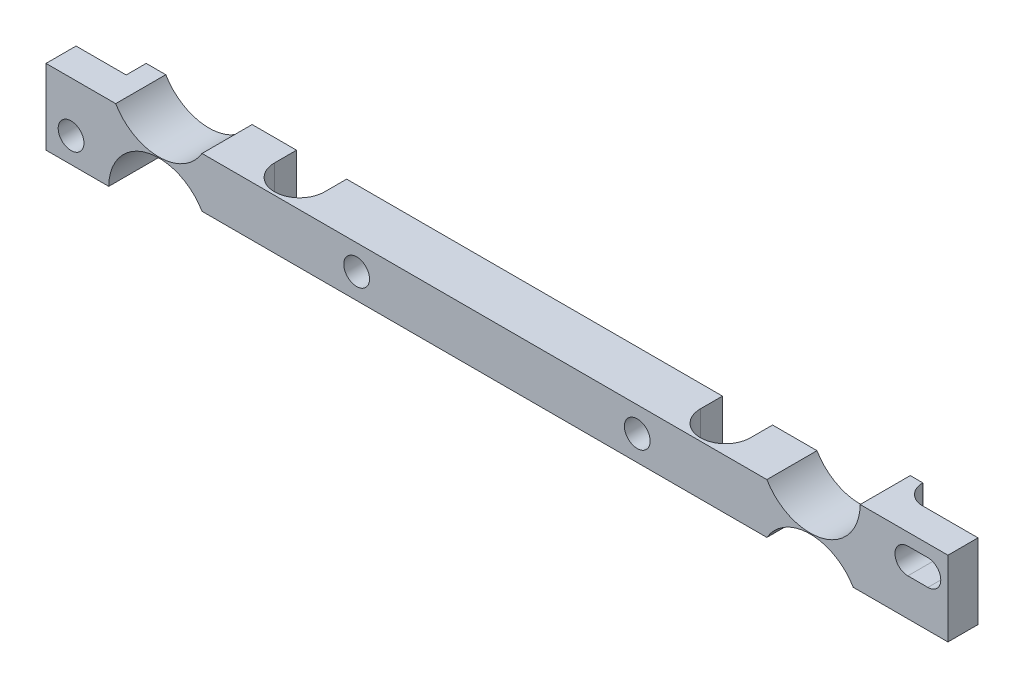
SolidWorks part; units mm, degrees
ref_plane "Front Plane" through (0, 0, 0) normal (0, 0, 1) x (1, 0, 0)
ref_plane "Top Plane" through (0, 0, 0) normal (0, 1, 0) x (1, 0, 0)
ref_plane "Right Plane" through (0, 0, 0) normal (1, 0, 0) x (0, 0, -1)
sketch "Sketch1" plane through (0, 0, 0) normal (0, 0, 1) x (1, 0, 0)
  line L0 (0, 6.35) -> (114.3, 6.35) construction
  line L1 (0, 0) -> (6.35, 0)
  line L2 (0, 0) -> (0, 9.525)
  line L3 (0, 9.525) -> (6.35, 9.525)
  line L4 (6.35, 0) -> (6.35, 9.525)
  line L5 (7.9375, 0) -> (7.9504, 0)
  line L6 (6.35, 0) -> (7.9375, 0)
  line L7 (6.35, 0) -> (6.35, 9.525)
  line L8 (6.35, 9.525) -> (7.9375, 9.525)
  line L9 (7.9375, 0) -> (7.9375, 9.525)
  line L10 (114.3, 12.7) -> (107.95, 12.7)
  line L11 (114.3, 12.7) -> (114.3, 3.175)
  line L12 (114.3, 3.175) -> (107.95, 3.175)
  line L13 (107.95, 12.7) -> (107.95, 3.175)
  line L14 (107.95, 12.7) -> (103.1748, 12.7)
  line L15 (107.95, 12.7) -> (107.95, 3.175)
  line L16 (107.95, 3.175) -> (103.1748, 3.175)
  line L17 (103.1748, 12.7) -> (103.1748, 3.175)
  line L18 (103.1748, 3.175) -> (7.9375, 3.175)
  line L19 (103.1748, 3.175) -> (103.1748, 9.525)
  line L20 (103.1748, 9.525) -> (7.9375, 9.525)
  line L21 (7.9375, 3.175) -> (7.9375, 9.525)
  line L22 (7.9504, 0) -> (9.5258, 0)
  line L23 (103.1748, 12.7) -> (101.5992, 12.7)
  line L25 (111.125, 7.893) -> (111.76, 7.8931)
  line L26 (111.125, 7.893) -> (111.125, 11.157)
  line L27 (111.125, 11.157) -> (111.76, 11.157)
  line L28 (111.76, 7.8931) -> (111.76, 11.157)
  line L29 (111.125, 7.893) -> (109.22, 7.8931)
  line L30 (111.125, 7.893) -> (111.125, 11.157)
  line L31 (111.125, 11.157) -> (109.22, 11.157)
  line L32 (109.22, 7.8931) -> (109.22, 11.157)
  circle A0 centre (3.175, 3.175) radius 1.632
  circle A1 centre (14.3002, -0.0508) radius 6.35
  circle A2 centre (14.3002, 12.7508) radius 6.35
  circle A3 centre (111.125, 9.525) radius 1.632
  circle A4 centre (96.8248, 12.7508) radius 6.35
  circle A5 centre (96.8248, -0.0508) radius 6.35
  circle A6 centre (111.76, 9.525) radius 1.632
  circle A7 centre (109.22, 9.525) radius 1.632
  dimension "D3" = 3.2639
  dimension "D11" = 12.7
  dimension "D12" = 12.7
  dimension "D20" = 3.2639
  dimension "D24" = 12.7
  dimension "D25" = 12.7
  dimension "D1" = 9.525
  dimension "D2" = 6.35
  dimension "D4" = 3.175
  dimension "D5" = 3.175
  dimension "D6" = 114.3
  dimension "D7" = 6.35
  dimension "D8" = 3.175
  dimension "D9" = 6.35
  dimension "D10" = 1.5875
  dimension "D13" = 11.1252
  dimension "D14" = 11.1252
  dimension "D15" = 6.4008
  dimension "D16" = 6.4008
  dimension "D17" = 6.35
  dimension "D18" = 6.35
  dimension "D19" = 3.175
  dimension "D21" = 3.175
  dimension "D22" = 3.175
  dimension "D23" = 4.7752
  dimension "D26" = 6.4008
  dimension "D27" = 6.4008
  dimension "D28" = 6.35
  dimension "D29" = 6.35
  dimension "D30" = 1.905
  dimension "D31" = 0.635
extrude "Extrude1" add sketch "Sketch1" along normal blind 6.35 contours L0 L4 L3 L2 | L7 L0 L2 L1 A0 | L21 L0 L7 L6 L9 | L0 L9 L8 L4 | L5 A1 L18 L9 | L0 L19 L20 A4 A2 L9 | L17 L0 L21 L18 A1 A5 | L23 A4 L20 L17 | L0 L15 L14 L17 L19 | L0 L11 L10 L15 A3 | L13 L0 L17 L16 | L11 L0 L13 L12
sketch "Sketch2" plane through (0, 0, 0) normal (0, -1, 0) x (1, 0, 0)
  line L1 (0, 0) -> (6.35, 0)
  line L2 (0, 0) -> (0, 2.54)
  line L3 (0, 2.54) -> (6.35, 2.54)
  line L4 (6.35, 0) -> (6.35, 2.54)
  dimension "D1" = 6.35
  dimension "D2" = 2.54
extrude "Cut-Extrude1" cut sketch "Sketch2" against normal through all
sketch "Sketch3" plane through (0, 3.175, 0) normal (0, -1, 0) x (1, 0, 0)
  line L1 (114.3, 0) -> (104.775, 0)
  line L2 (114.3, 0) -> (114.3, 2.54)
  line L4 (114.3, 2.54) -> (107.2896, 2.54)
  line L5 (114.3, 2.54) -> (114.3, 0)
  line L6 (114.3, 0) -> (104.775, 0)
  line L7 (104.775, 0.0254) -> (104.775, 0)
  arc A0 (104.775, 0.0254) -> (107.2896, 2.54) centre (107.2896, 0.0254) cw
  point P6 (104.775, 2.54)
  point P7 (104.775, 2.54)
  dimension "D2" = 2.5146
  dimension "D1" = 9.525
  dimension "D4" = 2.54
  dimension "D5" = 9.525
extrude "Cut-Extrude2" cut sketch "Sketch3" against normal through all contours A0 L7 L4 M1 M2
sketch "Sketch4" plane through (0, 9.525, 0) normal (0, 1, 0) x (1, 0, 0)
  line L0 (19.7698, -6.35) -> (91.3552, -6.35) construction
  line L1 (0, -6.35) -> (0, -2.54) construction
  line L2 (114.3, -6.35) -> (114.3, -2.54) construction
  line L3 (19.7698, 0) -> (91.3552, 0) construction
  line L4 (85.725, -2.794) -> (79.375, -2.794)
  line L5 (85.725, -2.794) -> (85.725, 0)
  line L6 (85.725, 0) -> (79.375, 0)
  line L7 (79.375, -2.794) -> (79.375, 0)
  line L9 (25.4, -2.794) -> (31.75, -2.794)
  line L10 (25.4, -2.794) -> (25.4, 0)
  line L11 (25.4, 0) -> (31.75, 0)
  line L12 (31.75, -2.794) -> (31.75, 0)
  circle A0 centre (28.575, -2.794) radius 3.175
  circle A1 centre (82.55, -2.794) radius 3.175
  point P6 (0, -4.445)
  point P9 (114.3, -4.445)
  dimension "D1" = 6.35
  dimension "D2" = 6.35
  dimension "D3" = 3.556
  dimension "D4" = 3.556
  dimension "D5" = 28.575
  dimension "D6" = 31.75
  dimension "D7" = 53.975
extrude "Cut-Extrude3" cut sketch "Sketch4" against normal through all contours A0 L10 M1 | A0 L12 M1 | L9 A0 L11 | L9 A0 | A1 L7 M1 | L4 A1 L6 | A1 L5 M1 | L4 A1
sketch "Sketch5" plane through (0, 0, 0) normal (0, 0, -1) x (-1, 0, 0)
  line L0 (-31.75, 9.525) -> (-79.375, 9.525) construction
  line L1 (0, 9.525) -> (0, 0) construction
  circle A0 centre (-74.93, 6.35) radius 1.6319
  circle A1 centre (-39.37, 6.35) radius 1.6319
  dimension "D1" = 3.2639
  dimension "D2" = 3.2639
  dimension "D3" = 3.175
  dimension "D4" = 3.175
  dimension "D5" = 39.37
  dimension "D6" = 39.37
extrude "Cut-Extrude4" cut sketch "Sketch5" against normal through all
